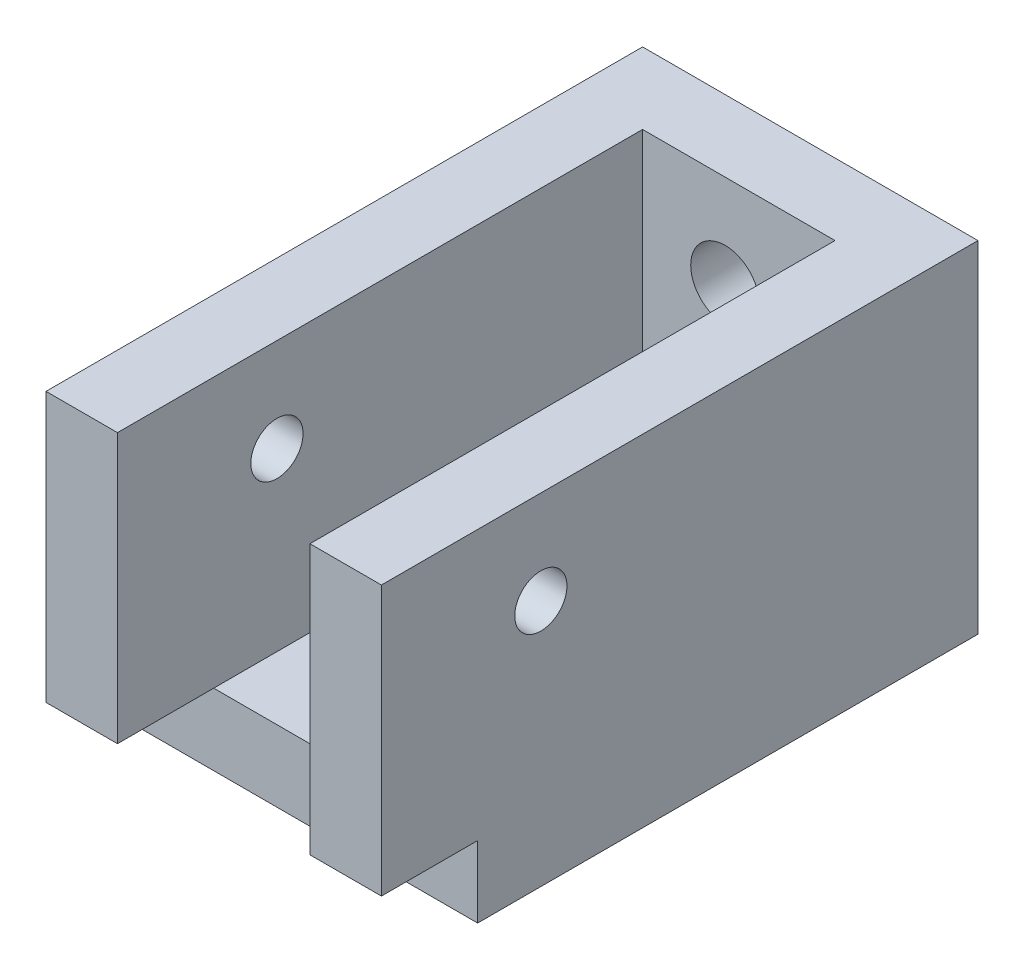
SolidWorks part; units mm, degrees
ref_plane "Plan de face" through (0, 0, 0) normal (0, 0, 1) x (1, 0, 0)
ref_plane "Plan de dessus" through (0, 0, 0) normal (0, 1, 0) x (1, 0, 0)
ref_plane "Plan de droite" through (0, 0, 0) normal (1, 0, 0) x (0, 0, -1)
sketch "Esquisse1" plane through (0, 0, 0) normal (0, 0, 1) x (1, 0, 0)
  line L1 (0, 0) -> (122, 0)
  line L2 (0, 0) -> (0, 124)
  line L3 (0, 124) -> (122, 124)
  line L4 (122, 0) -> (122, 124)
extrude "Extrusion1" add sketch "Esquisse1" along normal blind 26
sketch "Esquisse2" plane through (0, 0, 26) normal (0, 0, 1) x (1, 0, 0)
  line L1 (0, 124) -> (26, 124)
  line L2 (0, 124) -> (0, 26)
  line L3 (0, 26) -> (26, 26)
  line L4 (26, 124) -> (26, 26)
  line L5 (122, 124) -> (96, 124)
  line L6 (122, 124) -> (122, 26)
  line L7 (122, 26) -> (96, 26)
  line L8 (96, 124) -> (96, 26)
extrude "Extrusion2" add sketch "Esquisse2" along normal blind 191
sketch "Esquisse3" plane through (0, 0, 26) normal (0, 0, 1) x (1, 0, 0)
  line L1 (0, 0) -> (122, 0)
  line L2 (0, 0) -> (0, 26)
  line L3 (0, 26) -> (122, 26)
  line L4 (122, 0) -> (122, 26)
extrude "Extrusion3" add sketch "Esquisse3" along normal blind 156
sketch "Esquisse4" plane through (0, 0, 0) normal (0, 0, -1) x (-1, 0, 0)
  circle A0 centre (-56, 90) radius 12.5
extrude "Enlèv. mat.-Extru.1" cut sketch "Esquisse4" against normal through all
sketch "Esquisse5" plane through (0, 0, 0) normal (-1, 0, 0) x (0, 0, 1)
  circle A0 centre (159, 90) radius 9.5
extrude "Enlèv. mat.-Extru.2" cut sketch "Esquisse5" against normal through all
